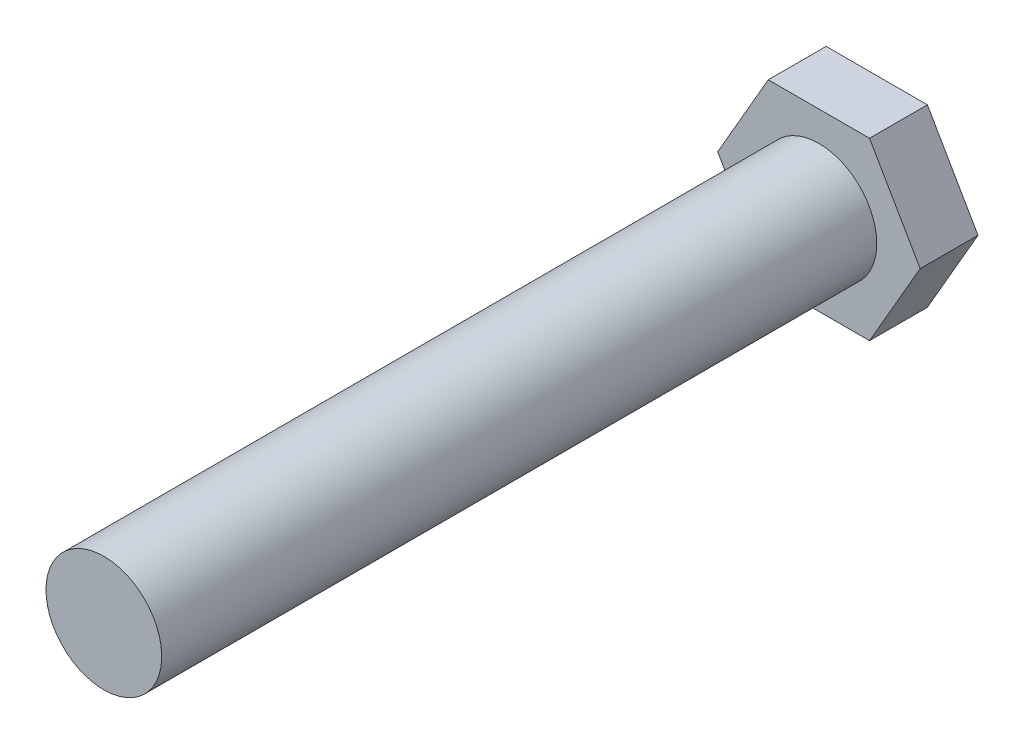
SolidWorks part; units mm, degrees
ref_plane "Front Plane" through (0, 0, 0) normal (0, 0, 1) x (1, 0, 0)
ref_plane "Top Plane" through (0, 0, 0) normal (0, 1, 0) x (1, 0, 0)
ref_plane "Right Plane" through (0, 0, 0) normal (1, 0, 0) x (0, 0, -1)
ref_plane "Plane1" through (0, 0, 12.7) normal (0, 0, 1) x (1, 0, 0)
sketch "Sketch1" plane through (0, 0, 12.7) normal (0, 0, 1) x (1, 0, 0)
  line L0 (11.1125, -19.2474) -> (22.225, 0)
  line L1 (22.225, 0) -> (11.1125, 19.2474)
  line L2 (11.1125, 19.2474) -> (-11.1125, 19.2474)
  line L3 (-11.1125, 19.2474) -> (-22.225, 0)
  line L4 (-22.225, 0) -> (-11.1125, -19.2474)
  line L5 (-11.1125, -19.2474) -> (11.1125, -19.2474)
extrude "Boss-Extrude1" add sketch "Sketch1" against normal blind 12.7
ref_plane "Plane2" through (0, 0, 0) normal (0, -1, 0) x (1, 0, 0)
sketch "Sketch2" plane through (0, 0, 0) normal (0, -1, 0) x (1, 0, 0)
  line L0 (12.7, 169.672) -> (0, 169.672)
  line L1 (0, 169.672) -> (0, 12.7)
  line L2 (0, 12.7) -> (12.7, 12.7)
  line L3 (12.7, 12.7) -> (12.7, 169.672)
  line L4 (0, 169.672) -> (0, 12.7) construction
revolve "Revolve1" add sketch "Sketch2" angle 360 about L4
